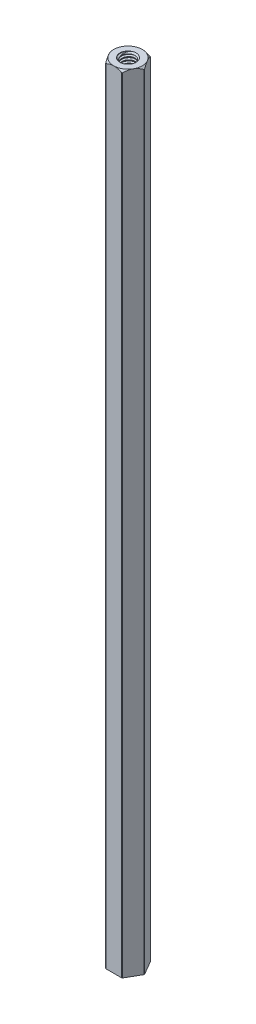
SolidWorks part; units mm, degrees
ref_plane "Front Plane" through (0, 0, 0) normal (0, 0, 1) x (1, 0, 0)
ref_plane "Top Plane" through (0, 0, 0) normal (0, 1, 0) x (1, 0, 0)
ref_plane "Right Plane" through (0, 0, 0) normal (1, 0, 0) x (0, 0, -1)
imported_body "Imported1"
sketch "Sketch1" plane through (0, 0, 0) normal (0, -1, 0) x (1, 0, 0)
  circle A0 centre (0, 0) radius 5.6018
extrude "Cut-Extrude1" cut sketch "Sketch1" against normal blind 70.6826
